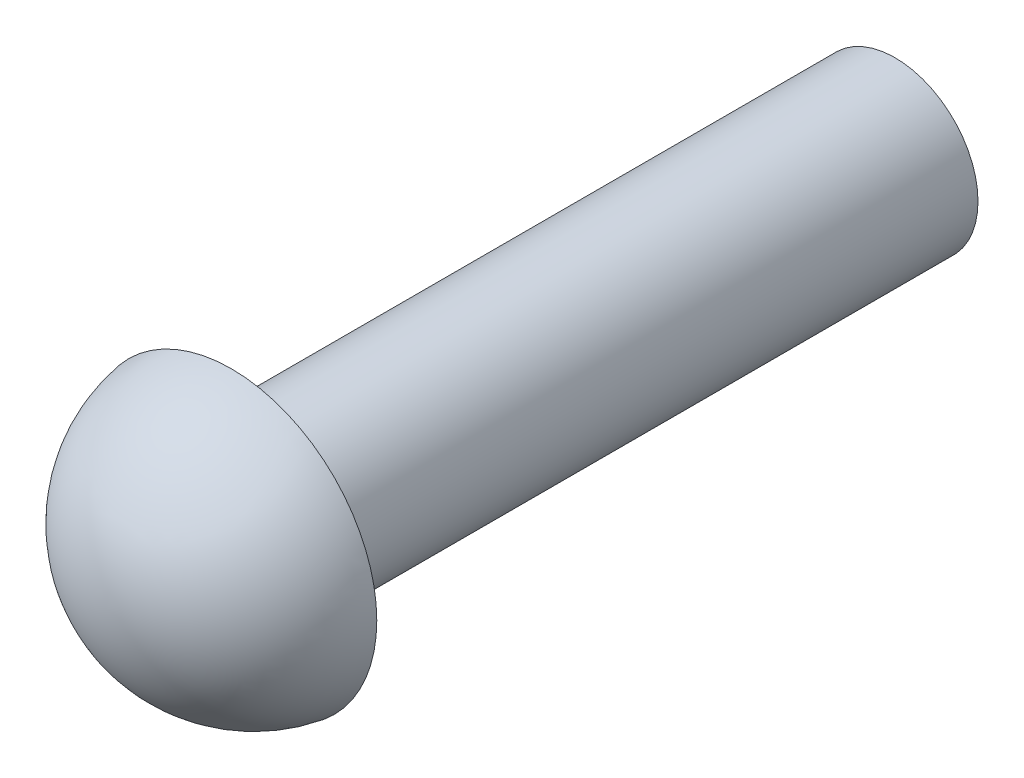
SolidWorks part; units mm, degrees
ref_plane "Front Plane" through (0, 0, 0) normal (0, 0, 1) x (1, 0, 0)
ref_plane "Top Plane" through (0, 0, 0) normal (0, 1, 0) x (1, 0, 0)
ref_plane "Right Plane" through (0, 0, 0) normal (1, 0, 0) x (0, 0, -1)
other "Configuration Table"
sketch "BaseBodySke" plane through (0, 0, 0) normal (0, 1, 0) x (1, 0, 0)
  line L0 (-5.5626, 4.7752) -> (-3.175, 4.7752)
  line L1 (0, 0) -> (0, 54.1082) construction
  line L2 (0, 0) -> (0, 30.1752)
  line L3 (0, 30.1752) -> (-3.175, 30.1752)
  line L4 (-3.175, 4.7752) -> (-3.175, 30.1752)
  line L5 (-5.5626, 30.1752) -> (-5.5626, 4.7752) construction
  line L6 (-5.5626, 0) -> (-5.5626, 4.7752) construction
  arc A0 (-5.5626, 4.7752) -> (0, 0) centre (0, 5.6275) ccw
  dimension "Diameter" = 6.35
  dimension "Head_Diameter" = 11.1252
  dimension "Length" = 25.4
  dimension "Head_Depth" = 4.7752
revolve "BaseBody" add sketch "BaseBodySke" angle 360 about L1
